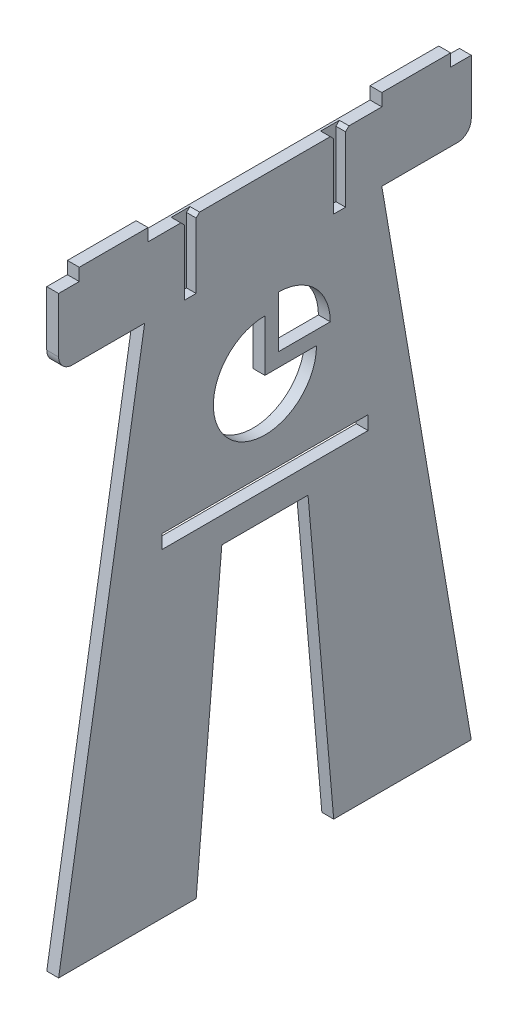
SolidWorks part; units mm, degrees
ref_plane "Front Plane" through (0, 0, 0) normal (0, 0, 1) x (1, 0, 0)
ref_plane "Top Plane" through (0, 0, 0) normal (0, 1, 0) x (1, 0, 0)
ref_plane "Right Plane" through (0, 0, 0) normal (1, 0, 0) x (0, 0, -1)
sketch "Sketch1" plane through (0, 0, 0) normal (1, 0, 0) x (0, 0, -1)
  line L0 (-80.3704, 0) -> (-50.3704, 0)
  line L1 (-50.3704, 0) -> (-50.3704, 18)
  line L2 (-50.3704, 18) -> (49.6296, 18)
  line L3 (49.6296, 18) -> (49.6296, 0)
  line L4 (49.6296, 0) -> (389.6296, 0)
  line L5 (389.6296, 0) -> (389.6296, 18)
  line L6 (389.6296, 18) -> (489.6296, 18)
  line L7 (489.6296, 18) -> (489.6296, 0)
  line L8 (489.6296, 0) -> (519.6296, 0)
  line L9 (519.6296, 0) -> (519.6296, -100)
  line L10 (-80.3704, -100) -> (44.7054, -100)
  line L11 (44.7054, -100) -> (-80.3704, -862)
  line L12 (-80.3704, -862) -> (119.6296, -862)
  line L13 (119.6296, -862) -> (156.9619, -435.2907)
  line L14 (156.9619, -435.2907) -> (282.2974, -435.2907)
  line L15 (319.6296, -862) -> (519.6296, -862)
  line L16 (519.6296, -862) -> (389.6296, -100)
  line L17 (389.6296, -100) -> (519.6296, -100)
  line L18 (-80.3704, -100) -> (-80.3704, 0)
  line L19 (282.2974, -435.2907) -> (319.6296, -862)
  dimension "D1" = 340
  dimension "D2" = 100
  dimension "D3" = 18
  dimension "D4" = 18
  dimension "D5" = 100
  dimension "D6" = 30
  dimension "D7" = 30
  dimension "D8" = 100
  dimension "D9" = 200
  dimension "D10" = 200
  dimension "D11" = 762
  dimension "D12" = 762
  dimension "D13" = 100
  dimension "D14" = 95
  dimension "D15" = 95
  dimension "D16" = 125.3356
  dimension "D17" = 80.679
extrude "Boss-Extrude1" add sketch "Sketch1" along normal blind 17.25
sketch "Sketch2" plane through (0, 0, 0) normal (1, 0, 0) x (0, 0, -1)
  line L0 (389.6296, 0) -> (49.6296, 0) construction
  line L1 (102.3796, 0) -> (119.6296, 0)
  line L2 (102.3796, 0) -> (102.3796, -100)
  line L3 (102.3796, -100) -> (119.6296, -100)
  line L4 (119.6296, 0) -> (119.6296, -100)
  line L5 (389.6296, 0) -> (49.6296, 0) construction
  line L7 (319.6296, 0) -> (336.8796, 0)
  line L8 (319.6296, 0) -> (319.6296, -100)
  line L9 (319.6296, -100) -> (336.8796, -100)
  line L10 (336.8796, 0) -> (336.8796, -100)
  point P6 (219.6296, 0)
  point P13 (219.6296, 0)
  dimension "D1" = 17.25
  dimension "D2" = 100
  dimension "D3" = 100
  dimension "D4" = 100
  dimension "D5" = 17.25
  dimension "D6" = 100
extrude "Cut-Extrude2" cut sketch "Sketch2" against normal blind 14 from surface at 17.25
fillet "Fillet1" radius 20 2 edges at (8.625, -100, -519.6296) (8.625, -100, 80.3704)
chamfer "Chamfer1" distance 5 angle 45 4 edges at (10.25, 0, -119.6296) (10.25, 0, -102.3796) (10.25, 0, -336.8796) (10.25, 0, -319.6296)
sketch "Sketch3" plane through (0, 0, 0) normal (1, 0, 0) x (0, 0, -1)
  line L0 (294.6296, -253.1753) -> (219.6296, -253.1753)
  line L1 (219.6296, -253.1753) -> (219.6296, -178.1753)
  arc A0 (219.6296, -178.1753) -> (294.6296, -253.1753) centre (219.6296, -253.1753) ccw
  dimension "D1" = 75
extrude "Pizza Cutout" cut sketch "Sketch3" against normal through all from surface at 17.25
sketch "Sketch4" plane through (0, 0, 0) normal (1, 0, 0) x (0, 0, -1)
  line L0 (314.6296, -233.1753) -> (239.6296, -233.1753)
  line L1 (239.6296, -233.1753) -> (239.6296, -158.1753)
  line L2 (219.6296, -253.1753) -> (219.6296, -178.1753) construction
  line L3 (294.6296, -253.1753) -> (219.6296, -253.1753) construction
  arc A0 (239.6296, -158.1753) -> (314.6296, -233.1753) centre (239.6296, -233.1753) cw
  dimension "D1" = 75
  dimension "D2" = 20
  dimension "D3" = 20
extrude "Cut-Extrude4" cut sketch "Sketch4" against normal through all from surface at 17.25
sketch "Sketch6" plane through (0, 0, 0) normal (1, 0, 0) x (0, 0, -1)
  line L0 (219.6296, -435.2907) -> (219.6296, -397.6345) construction
  line L1 (69.6296, -377.6345) -> (369.6296, -377.6345)
  line L2 (69.6296, -377.6345) -> (69.6296, -397.6345)
  line L3 (69.6296, -397.6345) -> (369.6296, -397.6345)
  line L4 (369.6296, -377.6345) -> (369.6296, -397.6345)
  line L5 (69.6296, -377.6345) -> (369.6296, -397.6345) construction
  line L6 (69.6296, -397.6345) -> (369.6296, -377.6345) construction
  line L7 (156.9619, -435.2907) -> (282.2974, -435.2907) construction
  point P0 (219.6296, -387.6345)
  dimension "D1" = 20
  dimension "D2" = 300
extrude "Cut-Extrude6" cut sketch "Sketch6" against normal through all from surface at 17.25
